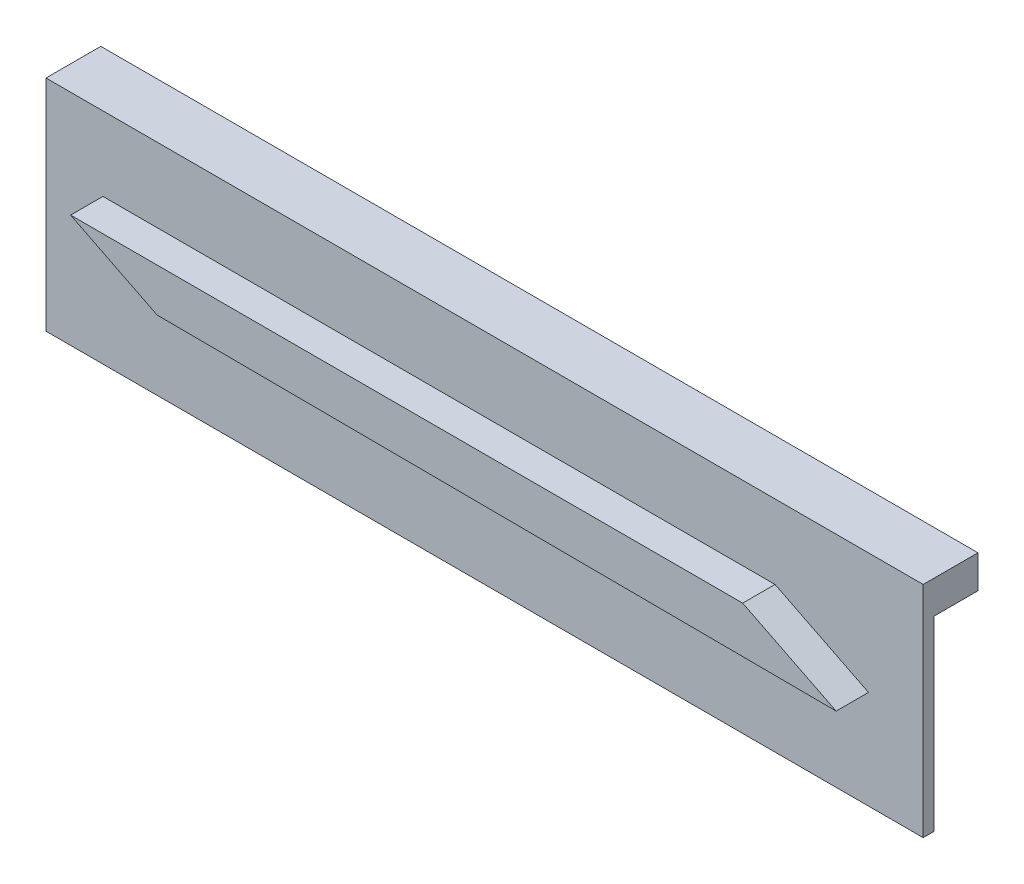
SolidWorks part; units mm, degrees
other "<灯光透明打印件>-<切除-拉伸2>"
ref_plane "前视基准面" through (0, 0, 0) normal (0, 0, 1) x (1, 0, 0)
ref_plane "上视基准面" through (0, 0, 0) normal (0, 1, 0) x (1, 0, 0)
ref_plane "右视基准面" through (0, 0, 0) normal (1, 0, 0) x (0, 0, -1)
mirrored part "灯光透明打印件_镜向"
